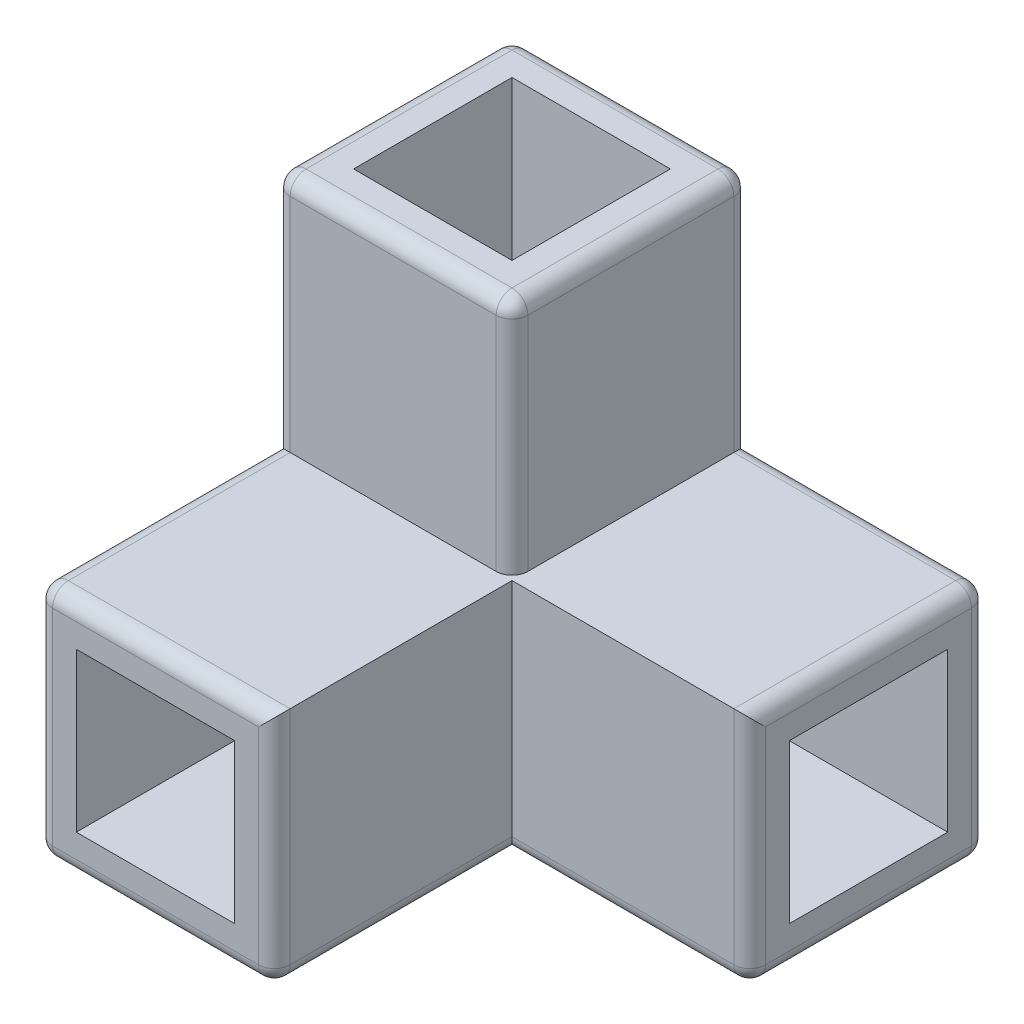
SolidWorks part; units mm, degrees
ref_plane "Alzado" through (0, 0, 0) normal (0, 0, 1) x (1, 0, 0)
ref_plane "Planta" through (0, 0, 0) normal (0, 1, 0) x (1, 0, 0)
ref_plane "Vista lateral" through (0, 0, 0) normal (1, 0, 0) x (0, 0, -1)
sketch "Sketch1" plane through (0, 0, 0) normal (0, 0, 1) x (1, 0, 0)
  line L0 (60, 0) -> (0, 0)
  line L1 (0, 0) -> (0, 60)
  line L2 (0, 60) -> (30, 60)
  line L3 (30, 60) -> (30, 30)
  line L4 (30, 30) -> (60, 30)
  line L5 (60, 30) -> (60, 0)
  dimension "D1" = 60
  dimension "D2" = 60
  dimension "D3" = 30
  dimension "D4" = 30
extrude "Boss-Extrude1" add sketch "Sketch1" along normal blind 30
sketch "Sketch2" plane through (0, 0, 30) normal (0, 0, 1) x (1, 0, 0)
  line L0 (30, 30) -> (0, 30)
  line L1 (0, 60) -> (0, 0) construction
  line L2 (0, 30) -> (0, 0)
  line L3 (0, 0) -> (30, 0)
  line L4 (0, 0) -> (60, 0) construction
  line L5 (30, 0) -> (30, 30)
extrude "Boss-Extrude2" add sketch "Sketch2" along normal blind 30
fillet "Fillet2" radius 2 22 edges at (15, 60, 30) (30, 60, 15) (15, 60, 0) (0, 60, 15) (0, 15, 60) (0, 30, 45) (0, 30, 0) (0, 45, 30) (30, 45, 30) (60, 15, 0) (45, 30, 0) (30, 45, 0) (15, 30, 60) (60, 15, 30) (30, 15, 60) (0, 0, 30) (30, 0, 0) (60, 0, 15) (45, 0, 30) (30, 0, 45) (15, 0, 60) (60, 30, 15)
sketch "Sketch3" plane through (0, 0, 60) normal (0, 0, 1) x (1, 0, 0)
  line L0 (28, 0) -> (2, 0) construction
  line L1 (5, 25) -> (25, 25)
  line L2 (5, 25) -> (5, 5)
  line L3 (5, 5) -> (25, 5)
  line L4 (25, 25) -> (25, 5)
  line L5 (5, 25) -> (25, 5) construction
  line L6 (5, 5) -> (25, 25) construction
  line L7 (0, 2) -> (0, 28) construction
  point P0 (15, 15)
  dimension "D1" = 20
  dimension "D2" = 20
  dimension "D3" = 15
  dimension "D4" = 15
extrude "Cut-Extrude1" cut sketch "Sketch3" against normal blind 20
sketch "Sketch4" plane through (60, 0, 0) normal (1, 0, 0) x (0, 0, -1)
  line L0 (0, 28) -> (0, 2) construction
  line L1 (-25, 25) -> (-5, 25)
  line L2 (-25, 25) -> (-25, 5)
  line L3 (-25, 5) -> (-5, 5)
  line L4 (-5, 25) -> (-5, 5)
  line L5 (-25, 25) -> (-5, 5) construction
  line L6 (-25, 5) -> (-5, 25) construction
  line L7 (-2, 0) -> (-28, 0) construction
  point P0 (-15, 15)
  dimension "D1" = 20
  dimension "D2" = 20
  dimension "D3" = 15
  dimension "D4" = 15
extrude "Cut-Extrude2" cut sketch "Sketch4" against normal blind 20
sketch "Sketch5" plane through (0, 60, 0) normal (0, 1, 0) x (1, 0, 0)
  line L1 (5, -5) -> (25, -5)
  line L2 (5, -5) -> (5, -25)
  line L3 (5, -25) -> (25, -25)
  line L4 (25, -5) -> (25, -25)
  line L5 (5, -5) -> (25, -25) construction
  line L6 (5, -25) -> (25, -5) construction
  line L9 (2, 0) -> (28, 0) construction
  line L10 (0, -28) -> (0, -2) construction
  point P0 (15, -15)
  point P9 (-18.5071, -9.5844)
  dimension "D1" = 20
  dimension "D2" = 20
  dimension "D3" = 15
  dimension "D4" = 15
extrude "Cut-Extrude3" cut sketch "Sketch5" against normal blind 20
